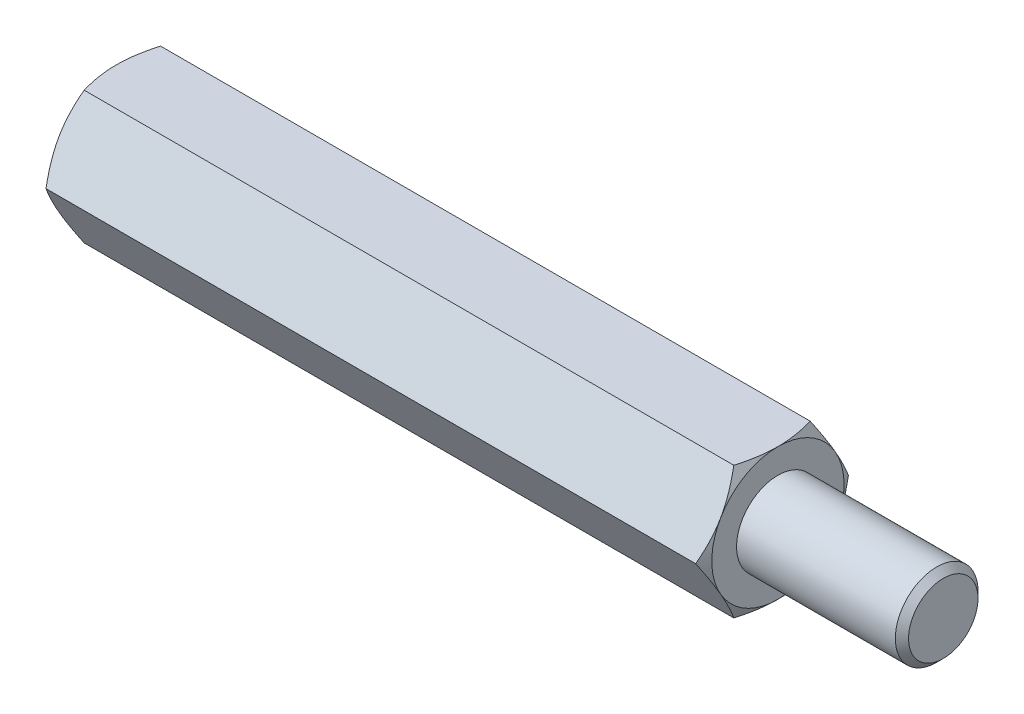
SolidWorks part; units mm, degrees
ref_plane "Front Plane" through (0, 0, 0) normal (0, 0, 1) x (1, 0, 0)
ref_plane "Top Plane" through (0, 0, 0) normal (0, 1, 0) x (1, 0, 0)
ref_plane "Right Plane" through (0, 0, 0) normal (1, 0, 0) x (0, 0, -1)
sketch "Sketch1" plane through (0, 0, 0) normal (1, 0, 0) x (0, 0, -1)
  line L1 (2.3094, 4) -> (-2.3094, 4)
  line L2 (-2.3094, 4) -> (-4.6188, 0)
  line L3 (-4.6188, 0) -> (-2.3094, -4)
  line L4 (-2.3094, -4) -> (2.3094, -4)
  line L5 (2.3094, -4) -> (4.6188, 0)
  line L6 (4.6188, 0) -> (2.3094, 4)
  circle A0 centre (0, 0) radius 4 construction
  dimension "D1" = 8
extrude "Extrude2" add sketch "Sketch1" along normal mid plane 40
sketch "Sketch2" plane through (0, 0, 0) normal (0, 0, 1) x (1, 0, 0)
  line L0 (-20, 4) -> (-18.5, 6.5981)
  line L1 (-20, 7) -> (-20, 4)
  line L3 (0, 0) -> (50000, 0) construction
  arc A0 (-18.5, 6.5981) -> (-20, 7) centre (-19.1962, 7) ccw
  dimension "D1" = 30
  dimension "D2" = 3
revolve "Cut-Revolve1" cut sketch "Sketch2" angle 360 about L3
mirror "Mirror1" about plane through (0, 0, 0) normal (1, 0, 0) of "Cut-Revolve1"
sketch "Sketch3" plane through (-20, 0, 0) normal (-1, 0, 0) x (0, 0, 1)
  circle A0 centre (0, 0) radius 2.1
  dimension "D1" = 4.2
extrude "Extrude3" cut sketch "Sketch3" against normal blind 10
sketch "Sketch4" plane through (0, 0, 0) normal (0, 0, 1) x (1, 0, 0)
  line L0 (-10, 0) -> (-10, 2.1)
  line L1 (19.6427, 0) -> (-19.6427, 0) construction
  line L2 (-10, 2.1) -> (-8.7876, 0)
  line L3 (-8.7876, 0) -> (-10, 0)
  line L4 (-20, 2) -> (-20, -2) construction
  point P4 (-20, 0)
  dimension "D1" = 30
  dimension "D2" = 2.1
  dimension "D3" = 10
revolve "Cut-Revolve2" cut sketch "Sketch4" angle 360 about L3
sketch "Sketch5" plane through (20, 0, 0) normal (1, 0, 0) x (0, 0, -1)
  circle A0 centre (0, 0) radius 2.5
  dimension "D1" = 5
extrude "Extrude4" add sketch "Sketch5" along normal blind 10
chamfer "Chamfer1" distance 0.4 angle 45 1 edges at (30, 0, -2.5)
equation "\"D2@Sketch4\" = \"D1@Sketch3\"/2"
